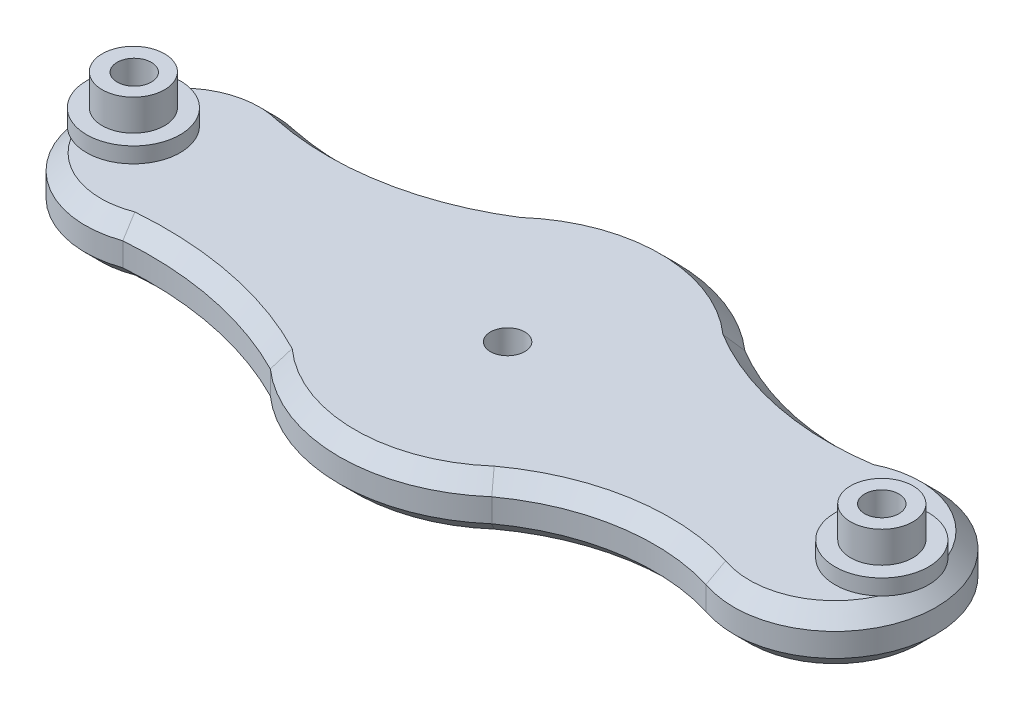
SolidWorks part; units mm, degrees
ref_plane "前视基准面" through (0, 0, 0) normal (0, 0, 1) x (1, 0, 0)
ref_plane "上视基准面" through (0, 0, 0) normal (0, 1, 0) x (1, 0, 0)
ref_plane "右视基准面" through (0, 0, 0) normal (1, 0, 0) x (0, 0, -1)
other "Configuration Table"
sketch "草图1" plane through (0, 0, 0) normal (0, 1, 0) x (1, 0, 0)
  arc A0 (-7.1019, -8.1164) -> (7.1019, -8.1164) centre (0, 0) ccw
  circle A1 centre (24, 0) radius 1.56
  arc A2 (18.8463, -6.1213) -> (18.2466, 5.876) centre (21, 0) ccw
  arc A3 (-18.9483, -5.7288) -> (-19.5083, 5.8994) centre (-21, 0) cw
  arc A4 (7.1019, 8.1164) -> (-7.1019, 8.1164) centre (0, 0) ccw
  circle A5 centre (-24, 0) radius 1.56
  circle A6 centre (0, 0) radius 2.72
  arc A11 (-19.5083, 5.8994) -> (-7.1019, 8.1164) centre (-16.0826, 22.5506) ccw
  arc A12 (-18.9483, -5.7288) -> (-7.1019, -8.1164) centre (-17.265, -27.9591) cw
  arc A13 (18.2466, 5.876) -> (7.1019, 8.1164) centre (15.8319, 22.7036) cw
  arc A14 (18.8463, -6.1213) -> (7.1019, -8.1164) centre (14.972, -18.8798) ccw
  dimension "D1" = 21
  dimension "D4" = 21
  dimension "D2" = 24
  dimension "D3" = 24
extrude "凸台-拉伸1" add sketch "草图1" along normal blind 3.5
sketch "草图2" plane through (0, 0, 0) normal (0, -1, 0) x (1, 0, 0)
  circle A0 centre (-24, 0) radius 2
  circle A1 centre (24, 0) radius 2
extrude "凸台-拉伸3" add sketch "草图2" against normal blind 6.5
chamfer "倒角1" distance 1 angle 45 16 edges at (0, 0, 10.7848) (0, 3.5, 10.7848) (-27.078, 0, 0.2927) (-27.078, 3.5, 0.2927) (0, 0, -10.7848) (0, 3.5, -10.7848) (27.481, 0, -0.324) (27.481, 3.5, -0.324) (-13.0921, 0, -5.8157) (-13.0921, 3.5, -5.8157) (12.4814, 0, -6.037) (12.4814, 3.5, -6.037) (-12.8602, 0, 6.1046) (-12.8602, 3.5, 6.1046) (12.7389, 0, 5.7343) (12.7389, 3.5, 5.7343)
sketch "草图4" plane through (0, 3.5, 0) normal (0, 1, 0) x (1, 0, 0)
  circle A0 centre (0, 0) radius 3.4
extrude "凸台-拉伸4" add sketch "草图4" against normal blind 3
sketch "草图6" plane through (0, 0, 0) normal (0, -1, 0) x (1, 0, 0)
  circle A0 centre (0, 0) radius 3.25
extrude "凸台-拉伸5" add sketch "草图6" along normal blind 4.3
sketch "草图7" plane through (0, -4.3, 0) normal (0, -1, 0) x (1, 0, 0)
  circle A0 centre (0, 0) radius 1.1
extrude "切除-拉伸3" cut sketch "草图7" against normal blind 5
sketch "草图10" plane through (0, 0, 0) normal (0, -1, 0) x (1, 0, 0)
  circle A0 centre (0, 0) radius 5
extrude "凸台-拉伸6" add sketch "草图10" along normal blind 0.5
sketch "草图12" plane through (0, 3.5, 0) normal (0, 1, 0) x (1, 0, 0)
  circle A0 centre (-24, 0) radius 3
  circle A1 centre (24, 0) radius 3
extrude "凸台-拉伸8" add sketch "草图12" along normal blind 1
sketch "草图13" plane through (0, 6.5, 0) normal (0, 1, 0) x (1, 0, 0)
  circle A0 centre (-23.9462, 0) radius 1.1
  circle A1 centre (24, 0) radius 1.1
extrude "切除-拉伸5" cut sketch "草图13" against normal blind 10
sketch "草图14" plane through (0, 0, 0) normal (0, -1, 0) x (1, 0, 0)
  line L1 (-21.9469, -1.501) -> (-21.6467, 0.9809)
  line L2 (-21.6467, 0.9809) -> (-23.646, 2.4819)
  line L3 (-23.646, 2.4819) -> (-25.9455, 1.501)
  line L4 (-25.9455, 1.501) -> (-26.2457, -0.9809)
  line L5 (-26.2457, -0.9809) -> (-24.2465, -2.4819)
  line L6 (-24.2465, -2.4819) -> (-21.9469, -1.501)
  line L7 (25.607, -1.915) -> (26.462, 0.4342)
  line L8 (26.462, 0.4342) -> (24.855, 2.3493)
  line L9 (24.855, 2.3493) -> (22.393, 1.915)
  line L10 (22.393, 1.915) -> (21.538, -0.4342)
  line L11 (21.538, -0.4342) -> (23.145, -2.3493)
  line L12 (23.145, -2.3493) -> (25.607, -1.915)
  circle A0 centre (-23.9462, 0) radius 2.1651 construction
  circle A1 centre (24, 0) radius 2.1651 construction
  dimension "D1" = 2.5
  dimension "D2" = 2.5
extrude "切除-拉伸6" cut sketch "草图14" against normal blind 2
sketch "草图15" plane through (0, -0.5, 0) normal (0, -1, 0) x (1, 0, 0)
  circle A0 centre (0, 0) radius 1.1
extrude "切除-拉伸7" cut sketch "草图15" against normal blind 5
sketch "草图16" plane through (0, -4.3, 0) normal (0, -1, 0) x (1, 0, 0)
  line L1 (1.8404, -1.6173) -> (2.3208, 0.7852)
  line L2 (2.3208, 0.7852) -> (0.4804, 2.4024)
  line L3 (0.4804, 2.4024) -> (-1.8404, 1.6173)
  line L4 (-1.8404, 1.6173) -> (-2.3208, -0.7852)
  line L5 (-2.3208, -0.7852) -> (-0.4804, -2.4024)
  line L6 (-0.4804, -2.4024) -> (1.8404, -1.6173)
  circle A0 centre (0, 0) radius 2.1218 construction
  dimension "D1" = 2.45
extrude "切除-拉伸8" cut sketch "草图16" against normal blind 3.25
